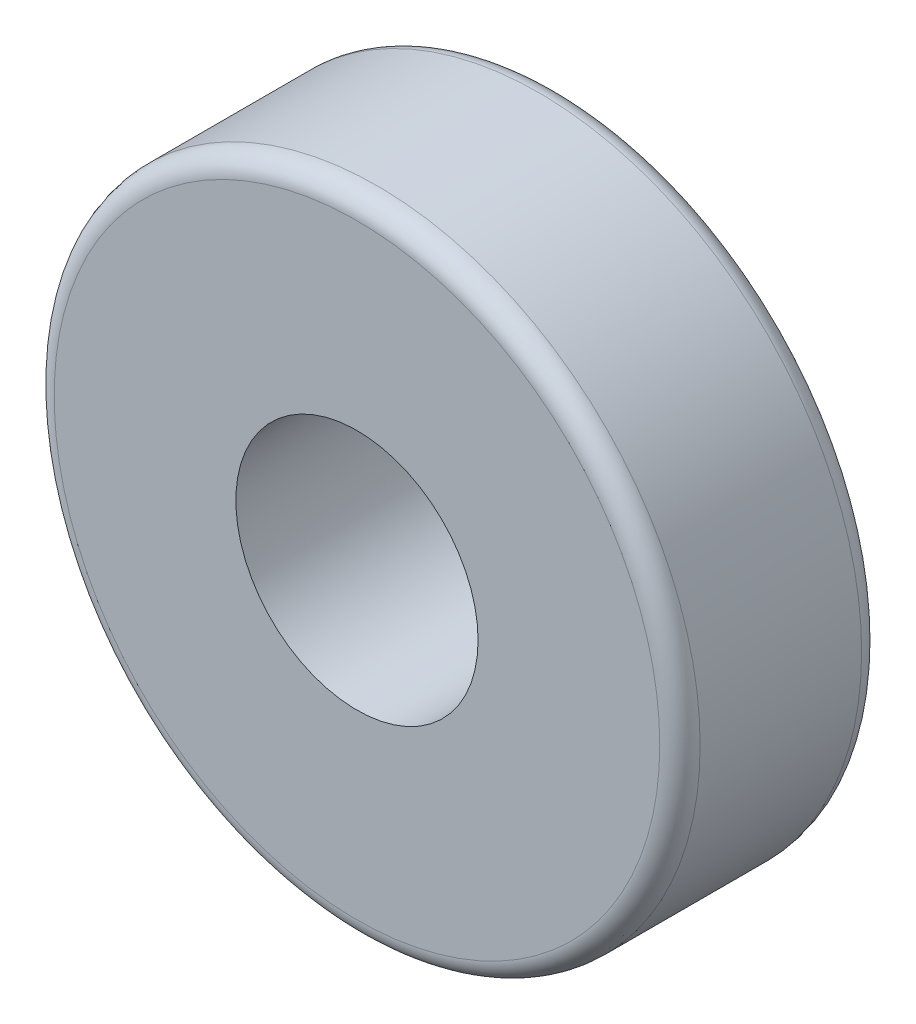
SolidWorks part; units mm, degrees
ref_plane "Plan de face" through (0, 0, 0) normal (0, 0, 1) x (1, 0, 0)
ref_plane "Plan de dessus" through (0, 0, 0) normal (0, 1, 0) x (1, 0, 0)
ref_plane "Plan de droite" through (0, 0, 0) normal (1, 0, 0) x (0, 0, -1)
sketch "Esquisse1" plane through (0, 0, 0) normal (0, 0, 1) x (1, 0, 0)
  circle A0 centre (0, 0) radius 16
  circle A1 centre (0, 0) radius 6
  dimension "D1" = 12
  dimension "D2" = 32
extrude "Extrusion1" add sketch "Esquisse1" along normal blind 10
fillet "Congé1" radius 1 3 edges at (16, 0, 10) (6, 0, 0) (16, 0, 0)
